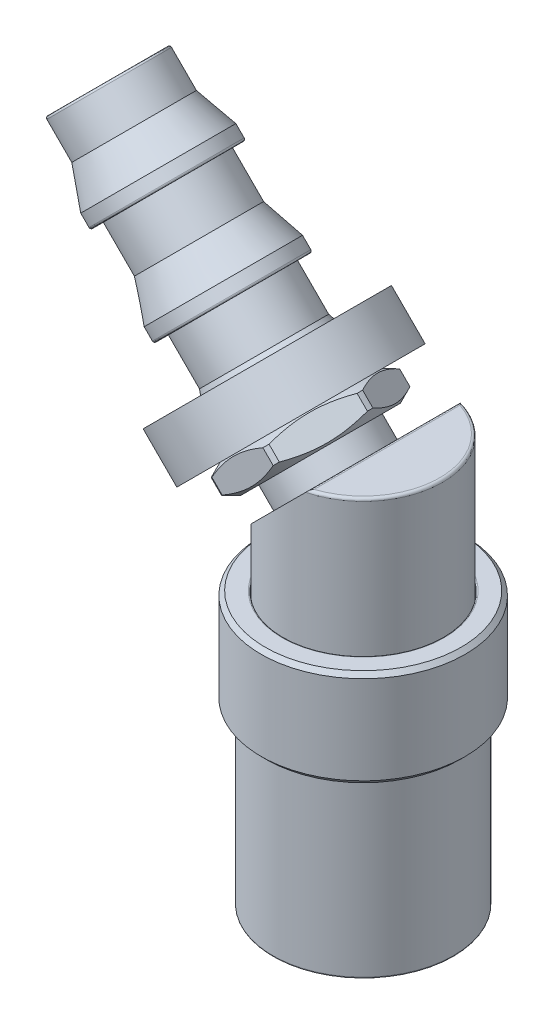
SolidWorks part; units mm, degrees
other "Body"
ref_plane "Front Plane" through (0, 0, 0) normal (0, 0, 1) x (1, 0, 0)
ref_plane "Top Plane" through (0, 0, 0) normal (0, 1, 0) x (1, 0, 0)
ref_plane "Right Plane" through (0, 0, 0) normal (1, 0, 0) x (0, 0, -1)
imported_body "SC200S"
imported_body "BARB"
imported_body "BODY"
imported_body "PL-BARB"
imported_body "SLEEVE"
sketch "Sketch1" plane through (0, 0, 0) normal (0, 0, 1) x (1, 0, 0)
  line L0 (-4.7752, 8.1191) -> (-3.175, 7.1952)
  line L1 (-3.175, 7.1952) -> (-3.175, 2.3876)
  line L2 (-3.175, 2.3876) -> (-4.7752, 0.7874)
  line L3 (-4.7752, 0.7874) -> (-4.7752, 8.1191)
  line L4 (-5.0546, 8.2804) -> (-4.7752, 8.1191) construction
  line L5 (-5.5626, 0) -> (-4.7752, 0.7874) construction
  line L6 (0, 7.4093) -> (0, -1.472) construction
  dimension "D1" = 6.35
revolve "Revolve1" add sketch "Sketch1" angle 360 about L6
sketch "Sketch2" plane through (0, 0, 0) normal (0, -1, 0) x (1, 0, 0)
  line L1 (0, 5.2793) -> (-4.572, 2.6396)
  line L2 (-4.572, 2.6396) -> (-4.572, -2.6396)
  line L3 (-4.572, -2.6396) -> (0, -5.2793)
  line L4 (0, -5.2793) -> (4.572, -2.6396)
  line L5 (4.572, -2.6396) -> (4.572, 2.6396)
  line L6 (4.572, 2.6396) -> (0, 5.2793)
  circle A0 centre (0, 0) radius 4.572 construction
  dimension "D1" = 9.144
extrude "Cut-Extrude1" cut sketch "Sketch2" against normal up to surface (9.3379 mm away)
